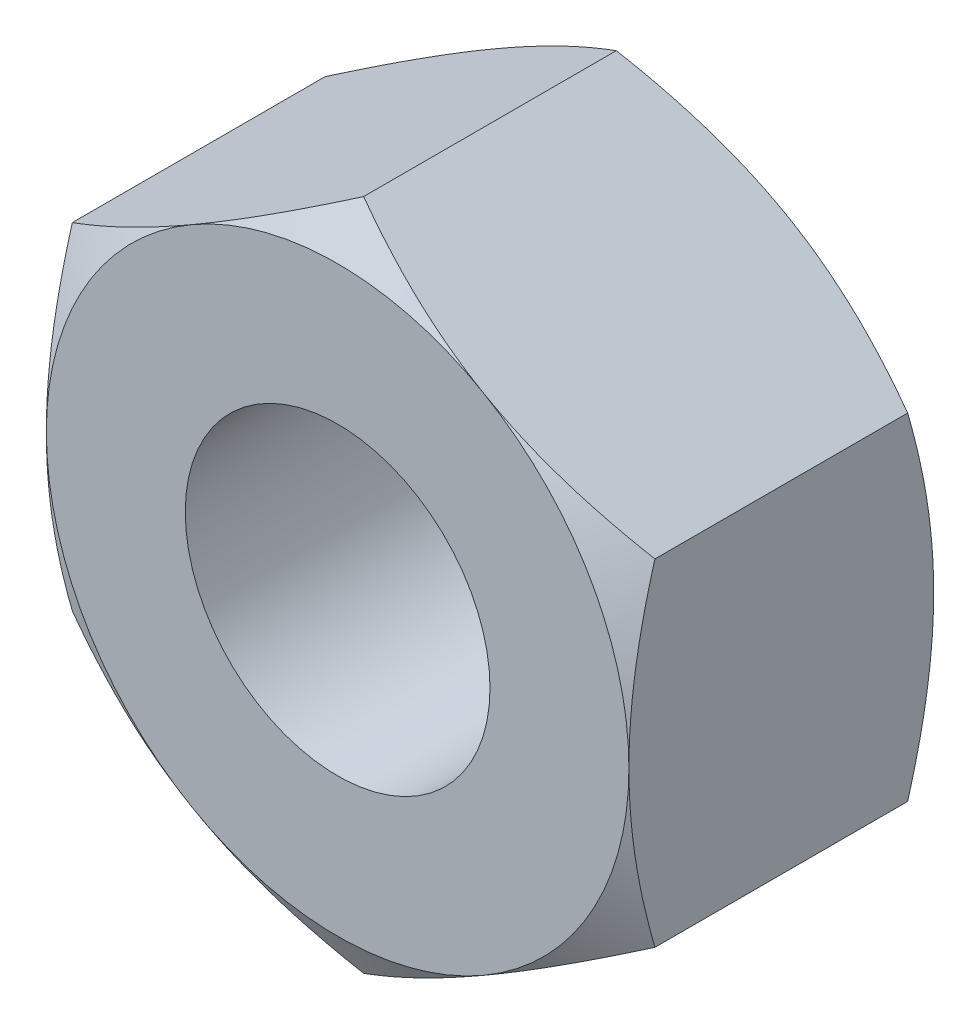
SolidWorks part; units mm, degrees
ref_plane "正面" through (0, 0, 0) normal (0, 0, 1) x (1, 0, 0)
ref_plane "平面" through (0, 0, 0) normal (0, 1, 0) x (1, 0, 0)
ref_plane "右側面" through (0, 0, 0) normal (1, 0, 0) x (0, 0, -1)
sketch "ｽｹｯﾁ1" plane through (0, 0, 0) normal (0, 0, 1) x (1, 0, 0)
  line L1 (0, 7.5056) -> (-6.5, 3.7528)
  line L2 (-6.5, 3.7528) -> (-6.5, -3.7528)
  line L3 (-6.5, -3.7528) -> (0, -7.5056)
  line L4 (0, -7.5056) -> (6.5, -3.7528)
  line L5 (6.5, -3.7528) -> (6.5, 3.7528)
  line L6 (6.5, 3.7528) -> (0, 7.5056)
  circle A0 centre (0, 0) radius 6.5 construction
  dimension "D1" = 13
extrude "ﾎﾞｽ - 押し出し1" add sketch "ｽｹｯﾁ1" along normal mid plane 6.8
hole_wizard "M8 ねじ穴1" positions "ｽｹｯﾁ2" profile "ｽｹｯﾁ3" tap size "M8" standard "ISO"
sketch "ｽｹｯﾁ2" plane through (0, 0, -3.4) normal (0, 0, -1) x (-1, 0, 0)
  point P0 (0, 0)
sketch "ｽｹｯﾁ3" plane through (0, 0, -3.4) normal (1, 0, 0) x (0, 1, 0)
  line L0 (0, 0) -> (0, 6.8)
  line L1 (0, 6.8) -> (3.4, 6.8)
  line L2 (3.4, 6.8) -> (3.4, 0)
  line L5 (3.4, 0) -> (0, 0)
  line L11 (0, -6.35) -> (0, 107.95) construction
  dimension "次ｻｰﾌｪｽまでのねじ下穴ﾄﾞﾘﾙ直径" = 6.8
  dimension "次ｻｰﾌｪｽまでのねじ下穴ﾄﾞﾘﾙの深さ" = 6.8
sketch "ｽｹｯﾁ4" plane through (0, 0, 0) normal (0, 1, 0) x (1, 0, 0)
  line L8 (0, 0) -> (0, -3.4) construction
  line L10 (-6.5, -3.4) -> (-10.3061, -3.4)
  line L11 (-10.3061, -3.4) -> (-10.3061, -1.2025)
  line L12 (-10.3061, -1.2025) -> (-6.5, -3.4)
  dimension "D1" = 30
revolve "ｶｯﾄ - 回転1" cut sketch "ｽｹｯﾁ4" angle 360 about L8
mirror "ﾐﾗｰ1" about plane through (0, 0, 0) normal (0, 0, 1) of "ｶｯﾄ - 回転1"
